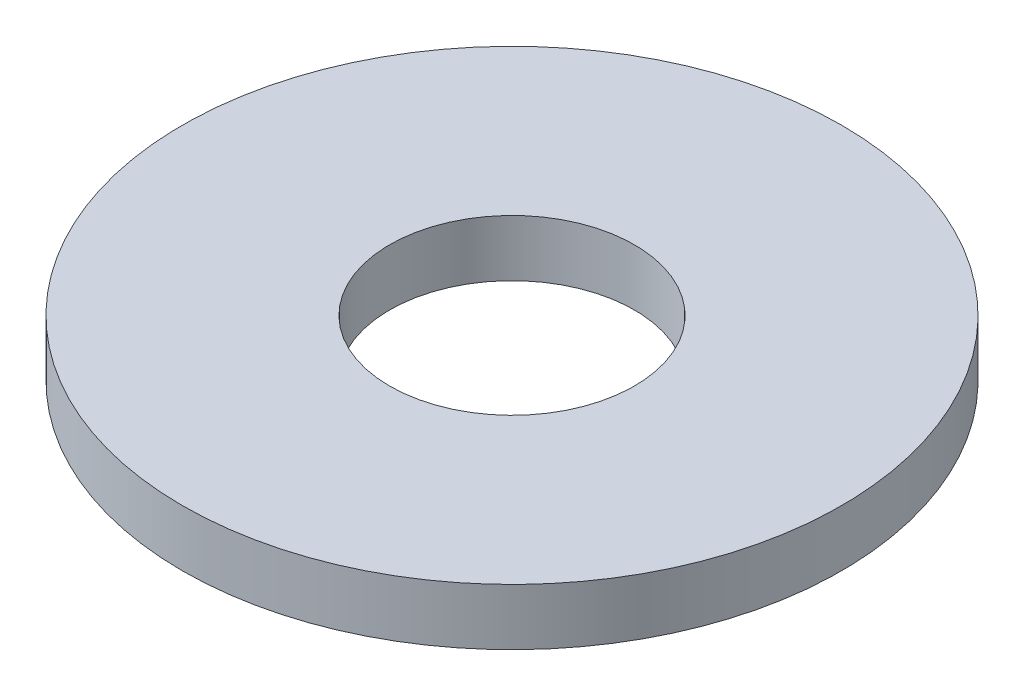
SolidWorks part; units mm, degrees
ref_plane "Front" through (0, 0, 0) normal (0, 0, 1) x (1, 0, 0)
ref_plane "Top" through (0, 0, 0) normal (0, 1, 0) x (1, 0, 0)
ref_plane "Right" through (0, 0, 0) normal (1, 0, 0) x (0, 0, -1)
sketch "Sketch1" plane through (0, 0, 0) normal (0, 1, 0) x (1, 0, 0)
  circle A0 centre (0, 0) radius 0.65
  circle A1 centre (0, 0) radius 1.75
extrude "Extrude1" add sketch "Sketch1" along normal blind 0.3
